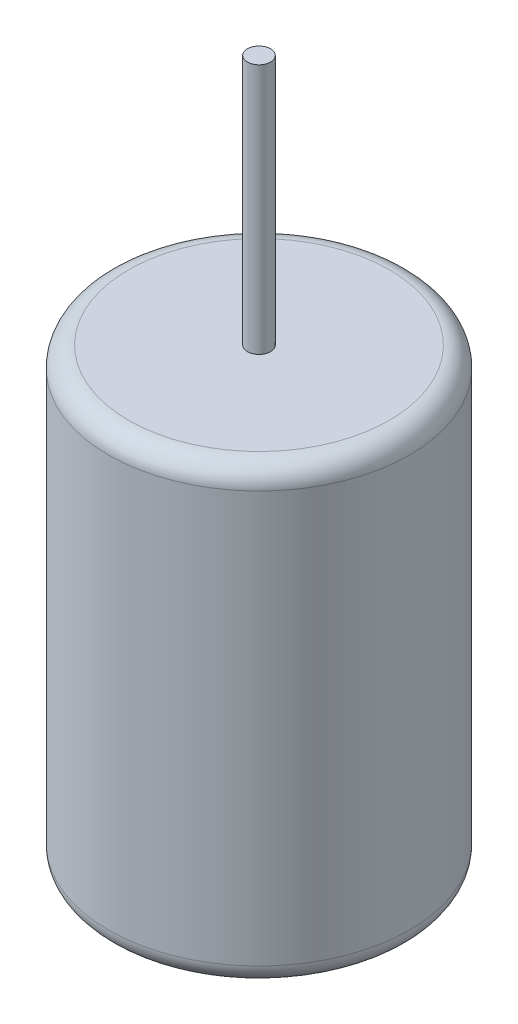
SolidWorks part; units mm, degrees
ref_plane "前视基准面" through (0, 0, 0) normal (0, 0, 1) x (1, 0, 0)
ref_plane "上视基准面" through (0, 0, 0) normal (0, 1, 0) x (1, 0, 0)
ref_plane "右视基准面" through (0, 0, 0) normal (1, 0, 0) x (0, 0, -1)
sketch "草图1" plane through (0, 0, 0) normal (0, 1, 0) x (1, 0, 0)
  circle A0 centre (0, 0) radius 15
  dimension "D1" = 30
extrude "凸台-拉伸1" add sketch "草图1" along normal blind 45
fillet "圆角1" radius 2 2 edges at (0, 0, 15) (0, 45, 15)
sketch "草图2" plane through (0, 45, 0) normal (0, 1, 0) x (1, 0, 0)
  circle A0 centre (0, 0) radius 1.15
  dimension "D1" = 2.3
extrude "凸台-拉伸2" add sketch "草图2" along normal blind 25
